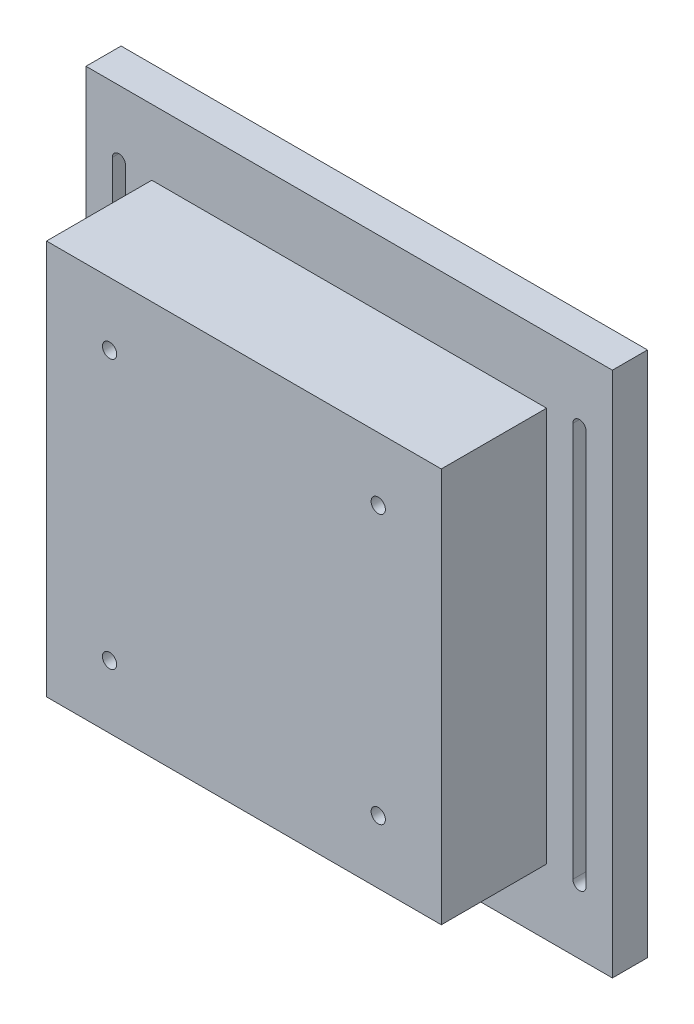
SolidWorks part; units mm, degrees
ref_plane "Ebene vorne" through (0, 0, 0) normal (0, 0, 1) x (1, 0, 0)
ref_plane "Ebene oben" through (0, 0, 0) normal (0, 1, 0) x (1, 0, 0)
ref_plane "Ebene rechts" through (0, 0, 0) normal (1, 0, 0) x (0, 0, -1)
sketch "Skizze1" plane through (0, 0, 0) normal (0, 0, 1) x (1, 0, 0)
  line L1 (0, 0) -> (240, 0)
  line L2 (0, 0) -> (0, 240)
  line L3 (0, 240) -> (240, 240)
  line L4 (240, 0) -> (240, 240)
  dimension "D1" = 240
  dimension "D2" = 240
extrude "Aufsatz-Linear austragen1" add sketch "Skizze1" along normal blind 16
sketch "Skizze2" plane through (0, 0, 16) normal (0, 0, 1) x (1, 0, 0)
  line L0 (120, 240) -> (120, 0) construction
  line L1 (240, 240) -> (0, 240) construction
  line L2 (0, 0) -> (240, 0) construction
  line L3 (0, 120) -> (240, 120) construction
  line L4 (0, 240) -> (0, 0) construction
  line L5 (240, 0) -> (240, 240) construction
  line L7 (30, 30) -> (210, 30)
  line L8 (30, 30) -> (30, 210)
  line L9 (30, 210) -> (210, 210)
  line L10 (210, 30) -> (210, 210)
  dimension "D1" = 30
  dimension "D2" = 30
  dimension "D3" = 30
  dimension "D4" = 180
extrude "Aufsatz-Linear austragen2" add sketch "Skizze2" along normal blind 48
sketch "Skizze3" plane through (0, 0, 0) normal (0, 0, -1) x (-1, 0, 0)
  line L0 (0, 240) -> (0, 0) construction
  line L1 (-200, 200) -> (-40, 200)
  line L2 (-200, 200) -> (-200, 40)
  line L3 (-200, 40) -> (-40, 40)
  line L4 (-40, 200) -> (-40, 40)
  line L5 (0, 0) -> (-240, 0) construction
  dimension "D1" = 160
  dimension "D2" = 160
  dimension "D3" = 40
  dimension "D4" = 40
extrude "Schnitt-Linear austragen1" cut sketch "Skizze3" against normal blind 48
sketch "Skizze4" plane through (0, 0, 64) normal (0, 0, 1) x (1, 0, 0)
  line L0 (30, 181.25) -> (210, 181.25) construction
  line L1 (30, 210) -> (30, 30) construction
  line L2 (210, 30) -> (210, 210) construction
  line L3 (30, 120) -> (210, 120) construction
  line L5 (30, 210) -> (30, 30) construction
  line L6 (210, 210) -> (30, 210) construction
  line L8 (181.25, 210) -> (181.25, 30) construction
  line L9 (30, 30) -> (210, 30) construction
  line L10 (120, 210) -> (120, 30) construction
  line L11 (210, 210) -> (30, 210) construction
  line L12 (210, 210) -> (181.25, 181.25) construction
  circle A0 centre (181.25, 181.25) radius 3.25
  circle A1 centre (58.75, 181.25) radius 3.25
  circle A2 centre (58.75, 58.75) radius 3.25
  circle A3 centre (181.25, 58.75) radius 3.25
  dimension "D3" = 6.5
  dimension "D1" = 61.25
  dimension "D2" = 61.25
sketch "Skizze5" plane through (0, 0, 16) normal (0, 0, 1) x (1, 0, 0)
  line L0 (15, 210) -> (15, 30) construction
  line L1 (0, 240) -> (0, 0) construction
  line L2 (30, 30) -> (0, 30) construction
  line L3 (240, 240) -> (0, 240) construction
  line L4 (18, 210) -> (18, 30)
  line L5 (120, 240) -> (120, 0) construction
  line L6 (0, 0) -> (240, 0) construction
  line L7 (30, 210) -> (0, 210) construction
  line L8 (12, 210) -> (12, 30)
  line L9 (225, 210) -> (225, 30) construction
  line L10 (222, 210) -> (222, 30)
  line L11 (228, 210) -> (228, 30)
  arc A0 (18, 210) -> (12, 210) centre (15, 210) ccw
  arc A1 (12, 30) -> (18, 30) centre (15, 30) ccw
  arc A2 (222, 210) -> (228, 210) centre (225, 210) cw
  arc A3 (228, 30) -> (222, 30) centre (225, 30) cw
  point P16 (15, 120)
  point P25 (225, 120)
  dimension "D1" = 6
extrude "Schnitt-Linear austragen2" cut sketch "Skizze5" against normal up to next
extrude "Schnitt-Linear austragen3" cut sketch "Skizze4" against normal up to next
